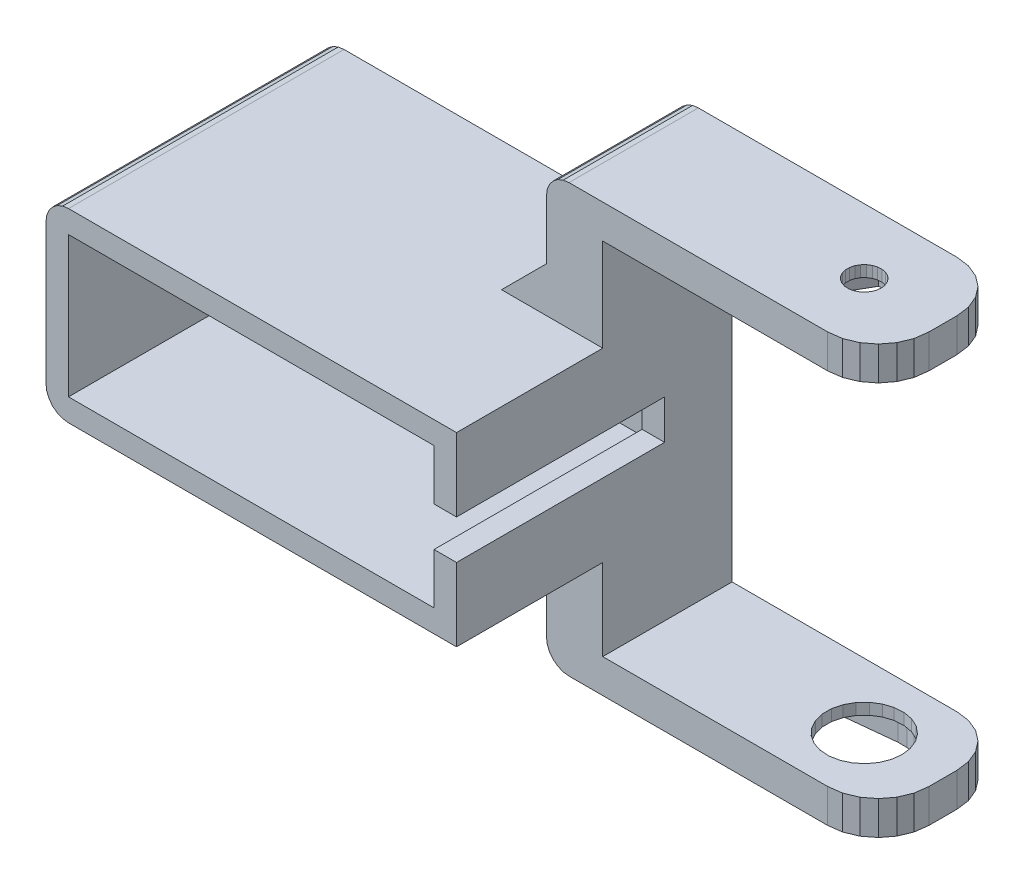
SolidWorks part; units mm, degrees
ref_plane "Front Plane" through (0, 0, 0) normal (0, 0, 1) x (1, 0, 0)
ref_plane "Top Plane" through (0, 0, 0) normal (0, 1, 0) x (1, 0, 0)
ref_plane "Right Plane" through (0, 0, 0) normal (1, 0, 0) x (0, 0, -1)
imported_body "Imported3"
sketch "Sketch1" plane through (0, 0, 11.5) normal (0, 0, 1) x (1, 0, 0)
  line L0 (0.0681, 1.4824) -> (0, 2)
  line L1 (0, 2) -> (0, 14.5)
  line L2 (0, 14.5) -> (0.0681, 15.0176)
  line L3 (0.0681, 15.0176) -> (0.2679, 15.5)
  line L4 (0.2679, 15.5) -> (0.5858, 15.9142)
  line L5 (0.5858, 15.9142) -> (1, 16.2321)
  line L6 (1, 16.2321) -> (1.4824, 16.4319)
  line L7 (1.4824, 16.4319) -> (2, 16.5)
  line L8 (2, 16.5) -> (36.5, 16.5)
  line L9 (36.5, 16.5) -> (36.5, 0)
  line L10 (36.5, 0) -> (2, 0)
  line L11 (2, 0) -> (1.4824, 0.0681)
  line L12 (1.4824, 0.0681) -> (1, 0.2679)
  line L13 (1, 0.2679) -> (0.5858, 0.5858)
  line L14 (0.5858, 0.5858) -> (0.2679, 1)
  line L15 (0.2679, 1) -> (0.0681, 1.4824)
  line L16 (56.5, -7.25) -> (56.5, -10.25) construction
  line L17 (56.5, -10.25) -> (33.5, -10.25) construction
  dimension "D1" = 20
  dimension "D2" = 54.5
  dimension "D3" = 55.0176
  dimension "D4" = 55.5
  dimension "D5" = 55.9142
  dimension "D6" = 56.2321
  dimension "D7" = 56.4319
  dimension "D8" = 56.5
  dimension "D9" = 10.25
  dimension "D10" = 10.3181
  dimension "D11" = 10.5179
  dimension "D12" = 10.8358
  dimension "D13" = 11.25
  dimension "D14" = 11.7324
  dimension "D15" = 12.25
  dimension "D16" = 24.75
  dimension "D17" = 25.2676
  dimension "D18" = 25.75
  dimension "D19" = 26.1642
  dimension "D20" = 26.4821
  dimension "D21" = 26.6819
  dimension "D22" = 26.75
extrude "Boss-Extrude1" add sketch "Sketch1" along normal blind 13
sketch "Sketch2" plane through (0, 0, 24.5) normal (0, 0, 1) x (1, 0, 0)
  line L0 (2, 14.5) -> (2, 2)
  line L1 (2, 2) -> (34.5, 2)
  line L2 (34.5, 2) -> (34.5, 14.5)
  line L3 (34.5, 14.5) -> (2, 14.5)
  line L4 (36.5, 0) -> (36.5, 16.5) construction
  line L5 (2, 0) -> (36.5, 0) construction
  dimension "D1" = 2
  dimension "D2" = 34.5
  dimension "D3" = 2
  dimension "D4" = 14.5
extrude "Cut-Extrude1" cut sketch "Sketch2" against normal blind 22.5
sketch "Sketch3" plane through (36.5, 0, 0) normal (1, 0, 0) x (0, 0, -1)
  line L0 (-24.5, 10) -> (-24.5, 6.5)
  line L1 (-24.5, 6.5) -> (-6, 6.5)
  line L2 (-6, 6.5) -> (-6, 10)
  line L3 (-6, 10) -> (-24.5, 10)
  line L4 (-11.5, 24.75) -> (-11.5, 16.5) construction
  line L5 (0, 24.75) -> (-11.5, 24.75) construction
  dimension "D1" = 5.5
  dimension "D2" = 13
  dimension "D3" = 14.75
  dimension "D4" = 18.25
extrude "Cut-Extrude2" cut sketch "Sketch3" against normal up to next
sketch "Sketch4" plane through (0, 24.75, 0) normal (0, -1, 0) x (1, 0, 0)
  line L0 (50.5, 5.75) -> (52.25, 2.7189)
  line L1 (52.25, 2.7189) -> (55.75, 2.7189)
  line L2 (55.75, 2.7189) -> (57.5, 5.75)
  line L3 (57.5, 5.75) -> (55.75, 8.7811)
  line L4 (55.75, 8.7811) -> (52.25, 8.7811)
  line L5 (52.25, 8.7811) -> (50.5, 5.75)
  line L6 (61, 4.5) -> (61, 7) construction
  dimension "D1" = 3.5
  dimension "D2" = 5.25
  dimension "D3" = 8.75
  dimension "D4" = 10.5
  dimension "D5" = 2.4147
  dimension "D6" = 5.4458
  dimension "D7" = 0.6164
extrude "Cut-Extrude3" cut sketch "Sketch4" against normal blind 2
sketch "Sketch5" plane through (0, 27.75, 0) normal (0, 1, 0) x (-1, 0, 0)
  line L0 (-54.4635, 7.1766) -> (-54.8037, 7.0165)
  line L1 (-54.8037, 7.0165) -> (-55.0935, 6.7768)
  line L2 (-55.0935, 6.7768) -> (-55.3145, 6.4726)
  line L3 (-55.3145, 6.4726) -> (-55.4529, 6.123)
  line L4 (-55.4529, 6.123) -> (-55.5, 5.75)
  line L5 (-55.5, 5.75) -> (-55.4529, 5.377)
  line L6 (-55.4529, 5.377) -> (-55.3145, 5.0274)
  line L7 (-55.3145, 5.0274) -> (-55.0935, 4.7232)
  line L8 (-55.0935, 4.7232) -> (-54.8037, 4.4835)
  line L9 (-54.8037, 4.4835) -> (-54.4635, 4.3234)
  line L10 (-54.4635, 4.3234) -> (-54.0942, 4.253)
  line L11 (-54.0942, 4.253) -> (-53.7189, 4.2766)
  line L12 (-53.7189, 4.2766) -> (-53.3613, 4.3928)
  line L13 (-53.3613, 4.3928) -> (-53.0439, 4.5942)
  line L14 (-53.0439, 4.5942) -> (-52.7865, 4.8683)
  line L15 (-52.7865, 4.8683) -> (-52.6053, 5.1978)
  line L16 (-52.6053, 5.1978) -> (-52.5118, 5.562)
  line L17 (-52.5118, 5.562) -> (-52.5118, 5.938)
  line L18 (-52.5118, 5.938) -> (-52.6053, 6.3022)
  line L19 (-52.6053, 6.3022) -> (-52.7865, 6.6317)
  line L20 (-52.7865, 6.6317) -> (-53.0439, 6.9058)
  line L21 (-53.0439, 6.9058) -> (-53.3613, 7.1072)
  line L22 (-53.3613, 7.1072) -> (-53.7189, 7.2234)
  line L23 (-53.7189, 7.2234) -> (-54.0942, 7.247)
  line L24 (-54.0942, 7.247) -> (-54.4635, 7.1766)
  line L25 (-61, 7) -> (-61, 4.5) construction
  line L27 (-56.5, 11.5) -> (-33.5, 11.5) construction
  dimension "D1" = 5.5
  dimension "D2" = 5.5471
  dimension "D3" = 5.6855
  dimension "D4" = 5.9065
  dimension "D5" = 6.1963
  dimension "D6" = 6.5365
  dimension "D7" = 6.9058
  dimension "D8" = 7.2811
  dimension "D9" = 7.6387
  dimension "D10" = 7.9561
  dimension "D11" = 8.2135
  dimension "D12" = 8.3947
  dimension "D13" = 8.4882
  dimension "D14" = 4.253
  dimension "D15" = 4.2766
  dimension "D16" = 4.3234
  dimension "D17" = 4.3928
  dimension "D18" = 4.4835
  dimension "D19" = 4.5942
  dimension "D20" = 4.7232
  dimension "D21" = 4.8683
  dimension "D22" = 5.0274
  dimension "D23" = 5.1978
  dimension "D24" = 5.377
  dimension "D25" = 5.562
  dimension "D26" = 5.75
  dimension "D27" = 5.938
  dimension "D28" = 6.123
  dimension "D29" = 6.3022
  dimension "D30" = 6.4726
  dimension "D31" = 6.6317
  dimension "D32" = 6.7768
  dimension "D33" = 6.9058
  dimension "D34" = 7.0165
  dimension "D35" = 7.1072
  dimension "D36" = 7.1766
  dimension "D37" = 7.2234
  dimension "D38" = 7.247
extrude "Cut-Extrude4" cut sketch "Sketch5" against normal through all
sketch "Sketch6" plane through (0, -7.25, 0) normal (0, 1, 0) x (1, 0, 0)
  circle A0 centre (54, -5.75) radius 3.35
